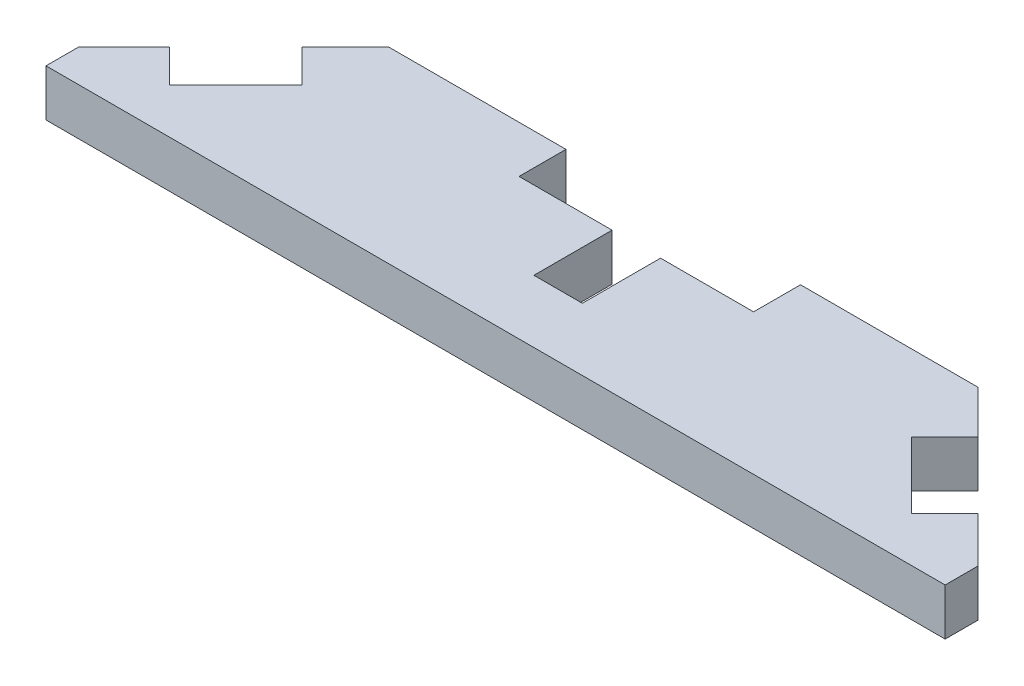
SolidWorks part; units mm, degrees
ref_plane "Front Plane" through (0, 0, 0) normal (0, 0, 1) x (1, 0, 0)
ref_plane "Top Plane" through (0, 0, 0) normal (0, 1, 0) x (1, 0, 0)
ref_plane "Right Plane" through (0, 0, 0) normal (1, 0, 0) x (0, 0, -1)
sketch "Sketch1" plane through (0, 0, 0) normal (0, 1, 0) x (1, 0, 0)
  line L0 (-18.85, 6) -> (-29.95, -5.1)
  line L1 (-18.85, -6) -> (18.85, -6)
  line L2 (-18.85, -6) -> (-18.85, 6) construction
  line L3 (-18.85, 6) -> (18.85, 6)
  line L4 (18.85, -6) -> (18.85, 6) construction
  line L5 (-18.85, -6) -> (18.85, 6) construction
  line L6 (-18.85, 6) -> (18.85, -6) construction
  line L7 (-29.95, -6) -> (-18.85, -6)
  line L8 (18.85, 6) -> (29.95, -5.1)
  line L9 (29.95, -6) -> (18.85, -6)
  line L10 (-29.95, -6) -> (-29.95, -5.1)
  line L11 (29.95, -6) -> (29.95, -5.1)
  point P0 (0, 0)
  dimension "D1" = 0.9
  dimension "D2" = 12
  dimension "D3" = 45
  dimension "D5" = 59.9
extrude "Boss-Extrude1" add sketch "Sketch1" along normal blind 3
sketch "Sketch2" plane through (0, 0, 0) normal (0, 1, 0) x (1, 0, 0)
  line L0 (0, 0) -> (0, 12.5228) construction
  line L1 (-25.8504, -1.0004) -> (-21.6077, 3.2423)
  line L2 (10.5, 3) -> (16.5, 3) construction
  line L3 (-25.8504, -1.0004) -> (-23.729, -3.1217)
  line L4 (-21.6077, 3.2423) -> (-19.4864, 1.121)
  line L5 (-23.729, -3.1217) -> (-19.4864, 1.121)
  line L6 (-18.85, 6) -> (-29.95, -5.1) construction
  line L7 (-16.5, 3) -> (-10.5, 3) construction
  line L8 (-16.5, 3) -> (-16.5, 0) construction
  line L9 (23.729, -3.1217) -> (19.4864, 1.121)
  line L10 (21.6077, 3.2423) -> (19.4864, 1.121)
  line L11 (25.8504, -1.0004) -> (23.729, -3.1217)
  line L12 (25.8504, -1.0004) -> (21.6077, 3.2423)
  line L13 (18.85, 6) -> (-18.85, 6) construction
  line L14 (-7.5, 3) -> (7.5, 3)
  line L15 (-7.5, 3) -> (-7.5, 6)
  line L16 (-7.5, 6) -> (7.5, 6)
  line L17 (7.5, 3) -> (7.5, 6)
  line L18 (-7.5, 3) -> (7.5, 6) construction
  line L19 (-7.5, 6) -> (7.5, 3) construction
  line L20 (-16.5, 0) -> (-10.5, 0) construction
  line L21 (-10.5, 3) -> (-10.5, 0) construction
  line L22 (10.5, 3) -> (10.5, 0) construction
  line L23 (10.5, 0) -> (16.5, 0) construction
  line L24 (16.5, 3) -> (16.5, 0) construction
  line L26 (-7.5, 0) -> (7.5, 0) construction
  line L27 (-7.5, 0) -> (-7.5, -3) construction
  line L28 (-7.5, -3) -> (7.5, -3) construction
  line L29 (7.5, 0) -> (7.5, -3) construction
  point P9 (0, 4.5)
  point P33 (-23.729, 1.121)
  dimension "D1" = 3
  dimension "D2" = 6
  dimension "D3" = 3.9
  dimension "D4" = 3
  dimension "D5" = 15
  dimension "D6" = 3
  dimension "D7" = 6
  dimension "D8" = 3
  dimension "D9" = 3
extrude "Cut-Extrude1" cut sketch "Sketch2" along normal blind 3
sketch "Sketch3" plane through (0, 0, 0) normal (0, 1, 0) x (1, 0, 0)
  line L0 (-7.5, 6) -> (7.5, 6) construction
  line L1 (0, 6) -> (0, 2) construction
  line L3 (-1.55, -2) -> (1.55, -2)
  line L4 (-1.55, -2) -> (-1.55, 6)
  line L5 (-1.55, 6) -> (1.55, 6)
  line L6 (1.55, -2) -> (1.55, 6)
  line L7 (-1.55, -2) -> (1.55, 6) construction
  line L8 (-1.55, 6) -> (1.55, -2) construction
  dimension "D1" = 3.1
  dimension "D2" = 8
extrude "Cut-Extrude2" cut sketch "Sketch3" along normal blind 10
sketch "Sketch4" plane through (0, 0, 0) normal (0, 1, 0) x (1, 0, 0)
  line L0 (0, 0) -> (0, 7.429) construction
  line L1 (-29.95, -6) -> (-28.75, -6)
  line L2 (-29.95, -6) -> (-29.95, 12.5929)
  line L3 (-29.95, 12.5929) -> (-28.75, 12.5929)
  line L4 (-28.75, -6) -> (-28.75, 12.5929)
  line L5 (28.75, -6) -> (28.75, 12.5929)
  line L6 (29.95, 12.5929) -> (28.75, 12.5929)
  line L7 (29.95, -6) -> (29.95, 12.5929)
  line L8 (29.95, -6) -> (28.75, -6)
  dimension "D1" = 1.2
extrude "Cut-Extrude3" cut sketch "Sketch4" along normal through all
